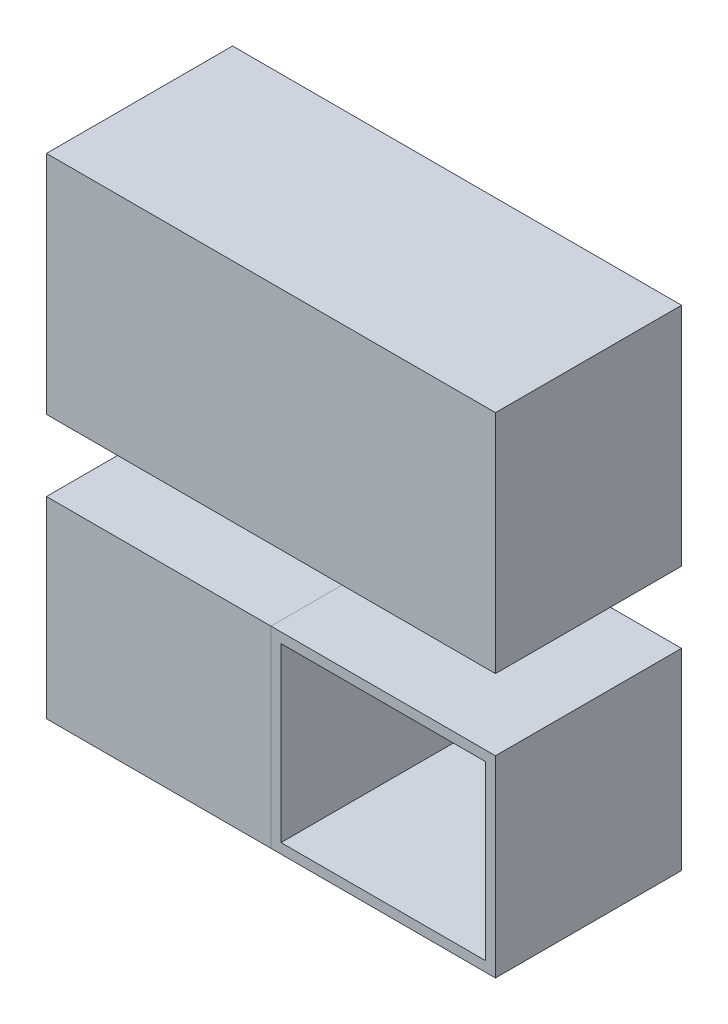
SolidWorks part; units mm, degrees
ref_plane "Front Plane" through (0, 0, 0) normal (0, 0, 1) x (1, 0, 0)
ref_plane "Top Plane" through (0, 0, 0) normal (0, 1, 0) x (1, 0, 0)
ref_plane "Right Plane" through (0, 0, 0) normal (1, 0, 0) x (0, 0, -1)
sketch "Sketch1" plane through (0, 0, 0) normal (0, 0, 1) x (1, 0, 0)
  line L1 (0, 0) -> (113.4006, 0)
  line L2 (0, 0) -> (0, 57.0817)
  line L3 (0, 57.0817) -> (113.4006, 57.0817)
  line L4 (113.4006, 0) -> (113.4006, 57.0817)
extrude "Extrude1" add sketch "Sketch1" against normal blind 46.99
sketch "Sketch2" plane through (0, 0, 0) normal (0, 0, 1) x (1, 0, 0)
  line L1 (0, -17.9629) -> (56.7003, -17.9629)
  line L2 (0, -17.9629) -> (0, -66.5731)
  line L3 (0, -66.5731) -> (56.7003, -66.5731)
  line L4 (56.7003, -17.9629) -> (56.7003, -66.5731)
extrude "Extrude2" add sketch "Sketch2" against normal up to vertex (46.99 mm away)
sketch "Sketch3" plane through (0, 0, 0) normal (0, 0, 1) x (1, 0, 0)
  line L0 (0, -66.5731) -> (56.7003, -66.5731) construction
  line L1 (56.7003, -66.5731) -> (113.4006, -66.5731)
  line L2 (56.7003, -66.5731) -> (56.7003, -17.9629)
  line L3 (56.7003, -17.9629) -> (113.4006, -17.9629)
  line L4 (113.4006, -66.5731) -> (113.4006, -17.9629)
extrude "Extrude3" add sketch "Sketch3" against normal up to vertex (46.99 mm away) separate body
shell "Shell1" thickness 2.54
